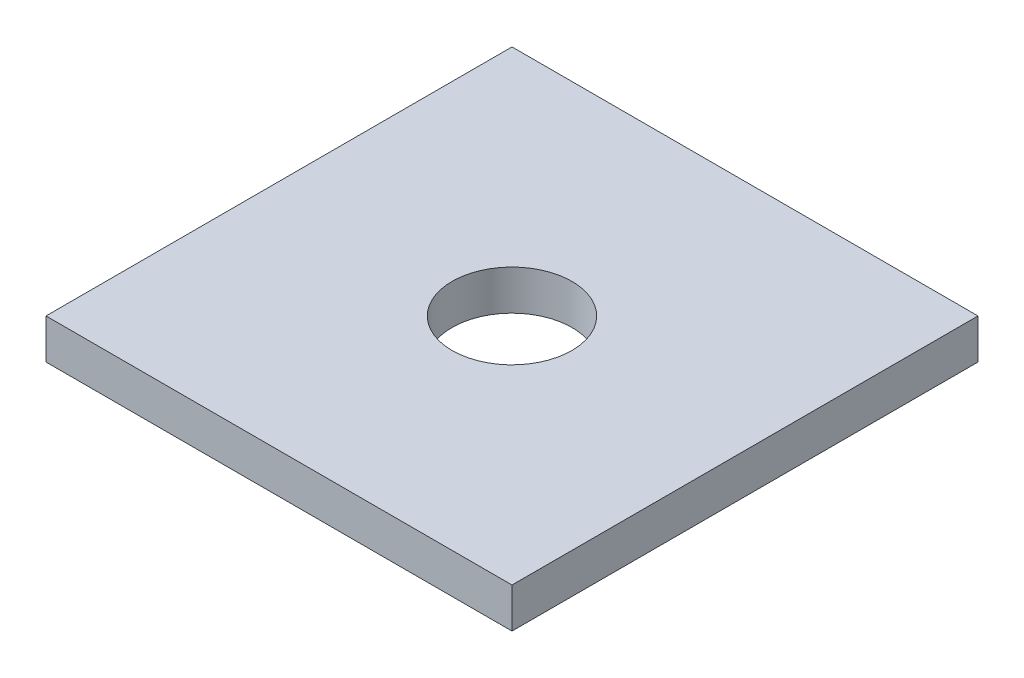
SolidWorks part; units mm, degrees
ref_plane "Front Plane" through (0, 0, 0) normal (0, 0, 1) x (1, 0, 0)
ref_plane "Top Plane" through (0, 0, 0) normal (0, 1, 0) x (1, 0, 0)
ref_plane "Right Plane" through (0, 0, 0) normal (1, 0, 0) x (0, 0, -1)
sketch "Sketch1" plane through (0, 0, 0) normal (0, 1, 0) x (1, 0, 0)
  line L0 (35, 35) -> (0, 0) construction
  line L1 (0, 0) -> (35, 0)
  line L2 (0, 0) -> (0, 35)
  line L3 (0, 35) -> (35, 35)
  line L4 (35, 0) -> (35, 35)
  circle A0 centre (17.5, 17.5) radius 4.5
  dimension "D3" = 9
  dimension "D1" = 35
  dimension "D2" = 35
extrude "Extrude1" add sketch "Sketch1" along normal blind 3
